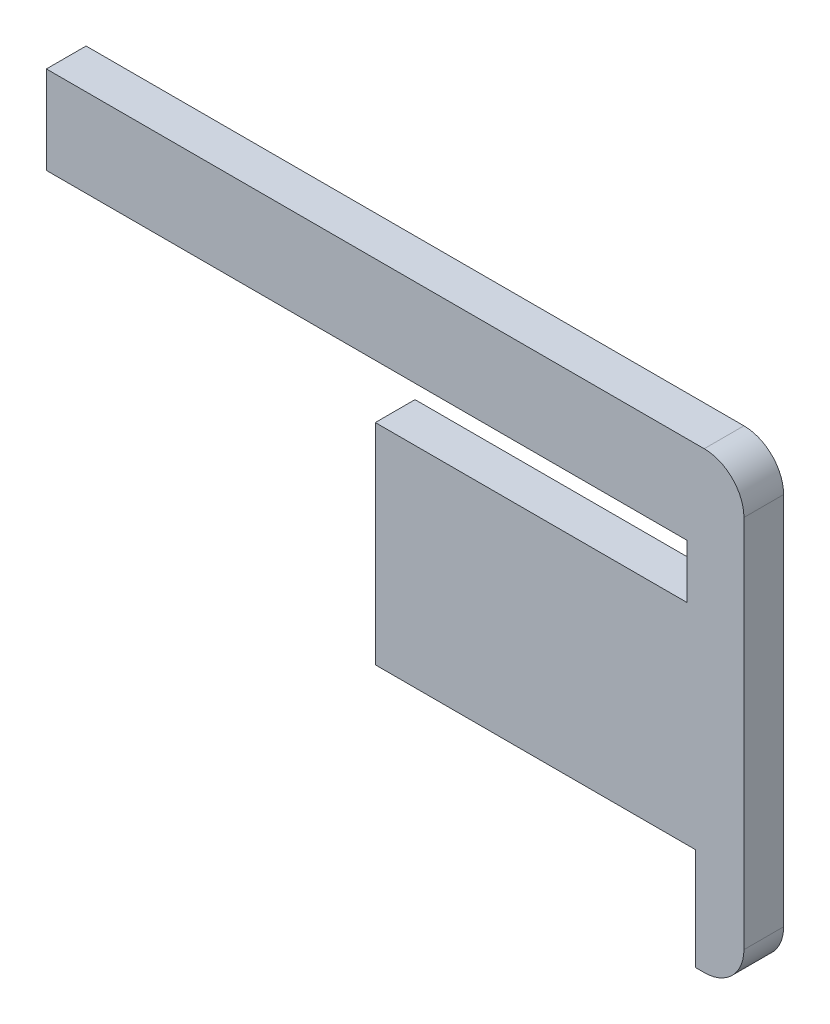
SolidWorks part; units mm, degrees
ref_plane "Front Plane" through (0, 0, 0) normal (0, 0, 1) x (1, 0, 0)
ref_plane "Top Plane" through (0, 0, 0) normal (0, 1, 0) x (1, 0, 0)
ref_plane "Right Plane" through (0, 0, 0) normal (1, 0, 0) x (0, 0, -1)
sketch "Sketch1" plane through (0, 0, 0) normal (0, 0, 1) x (1, 0, 0)
  line L1 (-10, 16) -> (0, 16)
  line L2 (-10, 16) -> (-10, 0)
  line L3 (-10, 0) -> (0, 0)
  line L4 (0, 16) -> (0, 0)
  dimension "D1" = 16
  dimension "D2" = 10
extrude "Boss-Extrude1" add sketch "Sketch1" along normal blind 1.4
fillet "Fillet1" radius 1.4 2 edges at (0, 0, 0.7) (0, 16, 0.7)
sketch "Sketch2" plane through (0, 0, 0) normal (0, 0, 1) x (1, 0, 0)
  line L0 (-10, 16) -> (-10, 0) construction
  line L1 (-10, 12.9) -> (-2, 12.9)
  line L2 (-10, 12.9) -> (-10, 11)
  line L3 (-10, 11) -> (-2, 11)
  line L4 (-2, 12.9) -> (-2, 11)
  line L5 (-1.4, 16) -> (-10, 16) construction
  line L6 (-10, 3.6) -> (-1.7, 3.6)
  line L7 (-10, 3.6) -> (-10, 0)
  line L8 (-10, 0) -> (-1.7, 0)
  line L9 (-1.7, 3.6) -> (-1.7, 0)
  line L10 (-10, 16) -> (-10, 0) construction
  line L13 (0, 1.4) -> (0, 14.6) construction
  dimension "D2" = 3.1
  dimension "D3" = 1.7
  dimension "D4" = 7.4
  dimension "D5" = 2
  dimension "D6" = 1.9
extrude "Cut-Extrude1" cut sketch "Sketch2" along normal blind 1.4
sketch "Sketch3" plane through (0, 0, 0) normal (0, 0, 1) x (1, 0, 0)
  line L1 (-10, 12.9) -> (-24.6, 12.9)
  line L2 (-10, 12.9) -> (-10, 16)
  line L3 (-10, 16) -> (-24.6, 16)
  line L4 (-24.6, 12.9) -> (-24.6, 16)
  line L5 (-10, 11) -> (-13, 11)
  line L6 (-10, 11) -> (-10, 3.6)
  line L7 (-10, 3.6) -> (-13, 3.6)
  line L8 (-13, 11) -> (-13, 3.6)
  dimension "D1" = 14.6
  dimension "D2" = 3
extrude "Boss-Extrude2" add sketch "Sketch3" along normal blind 1.4
